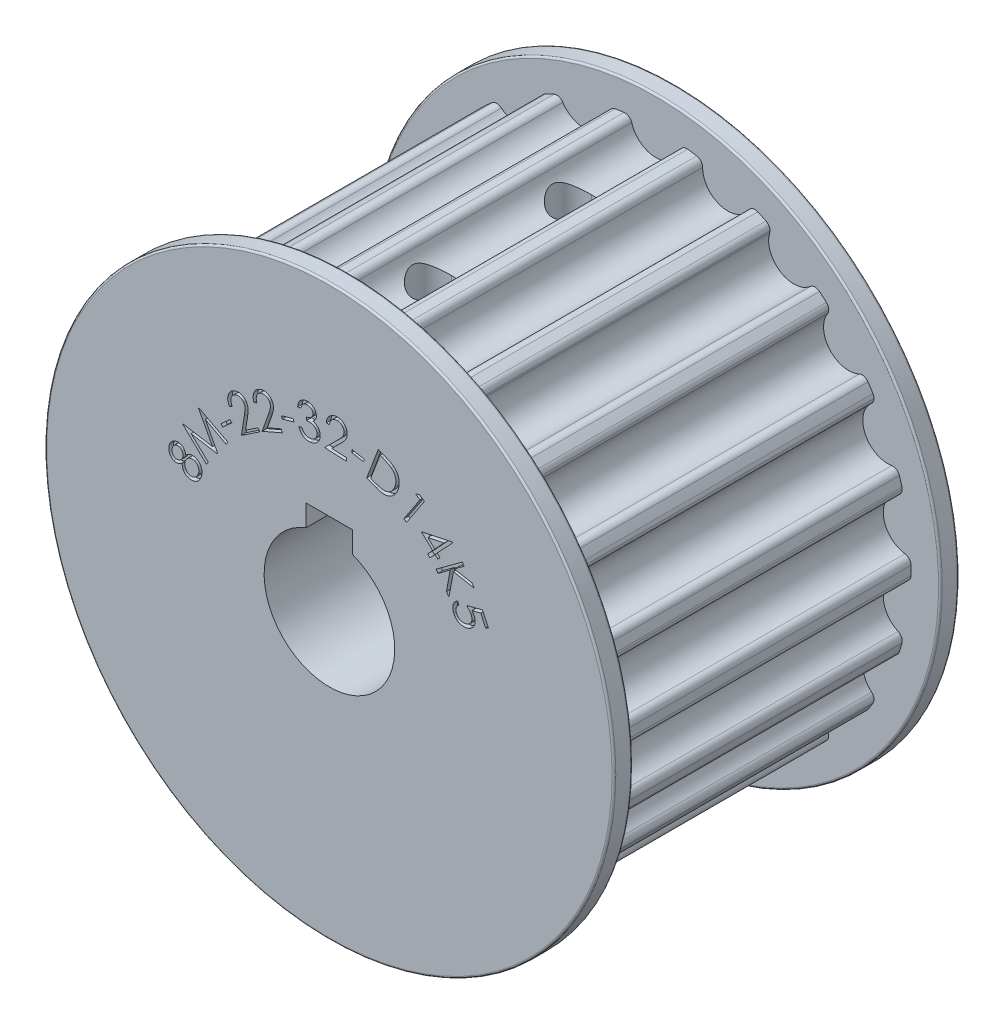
SolidWorks part; units mm, degrees
other "M5 Tapped Hole1[1]"
ref_plane "Front Plane" through (0, 0, 0) normal (0, 0, 1) x (1, 0, 0)
ref_plane "Top Plane" through (0, 0, 0) normal (0, 1, 0) x (1, 0, 0)
ref_plane "Right Plane" through (0, 0, 0) normal (1, 0, 0) x (0, 0, -1)
imported_body "Imported1"
sketch "Sketch1" plane through (0, 0, -2.5) normal (0, 0, -1) x (-1, 0, 0)
  circle A0 centre (0, 0) radius 30.5
extrude "Cut-Extrude1" cut sketch "Sketch1" against normal blind 1.5
sketch "Sketch2" plane through (0, 0, 37.5) normal (0, 0, 1) x (1, 0, 0)
  circle A0 centre (0, 0) radius 30.5
extrude "Cut-Extrude2" cut sketch "Sketch2" against normal blind 1.5
sketch "Sketch3" plane through (0, 0, 36) normal (0, 0, 1) x (1, 0, 0)
  line L0 (2.5, 8.8383) -> (2.5, 6.5383)
  line L1 (2.5, 8.8383) -> (-2.5, 8.8383)
  line L2 (-2.5, 8.8383) -> (-2.5, 6.5383)
  circle A0 centre (0, 0) radius 30.5
  arc A1 (-2.5, 6.5383) -> (2.5, 6.5383) centre (0, 0) ccw
extrude "Boss-Extrude1" add sketch "Sketch3" against normal blind 2
sketch "Sketch4" plane through (0, 0, -1) normal (0, 0, -1) x (-1, 0, 0)
  line L0 (2.5, 8.8383) -> (2.5, 6.5383)
  line L1 (2.5, 8.8383) -> (-2.5, 8.8383)
  line L2 (-2.5, 8.8383) -> (-2.5, 6.5383)
  circle A0 centre (0, 0) radius 30.5
  arc A1 (-2.5, 6.5383) -> (2.5, 6.5383) centre (0, 0) ccw
extrude "Boss-Extrude2" add sketch "Sketch4" against normal blind 2
sketch "Sketch5" plane through (0, 0, 36) normal (0, 0, 1) x (1, 0, 0)
  circle A0 centre (0, 0) radius 15 construction
  text T0 "8M-22-32-D14K5    "
extrude "Cut-Extrude3" cut sketch "Sketch5" against normal blind 0.5
fillet "Fillet1" radius 0.2 4 edges at (-30.5, 0, -1) (-30.5, 0, 1) (30.5, 0, 34) (30.5, 0, 36)
